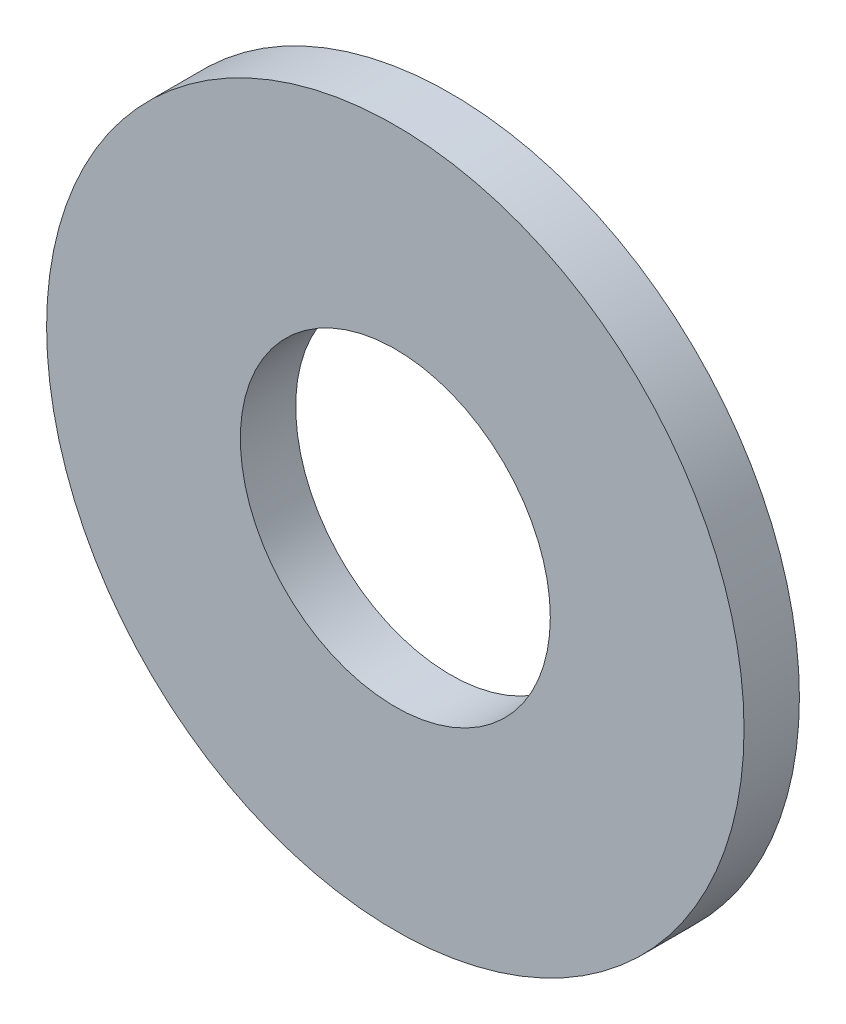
SolidWorks part; units mm, degrees
ref_plane "Front Plane" through (0, 0, 0) normal (0, 0, 1) x (1, 0, 0)
ref_plane "Top Plane" through (0, 0, 0) normal (0, 1, 0) x (1, 0, 0)
ref_plane "Right Plane" through (0, 0, 0) normal (1, 0, 0) x (0, 0, -1)
sketch "Sketch1" plane through (0, 0, 0) normal (0, 0, 1) x (1, 0, 0)
  circle A0 centre (0, 0) radius 3.556
  circle A1 centre (0, 0) radius 8.001
  point P4 (-3.556, 0)
  dimension "ID" = 7.112
  dimension "OD" = 16.002
extrude "Extrude1" add sketch "Sketch1" against normal blind 1.27
